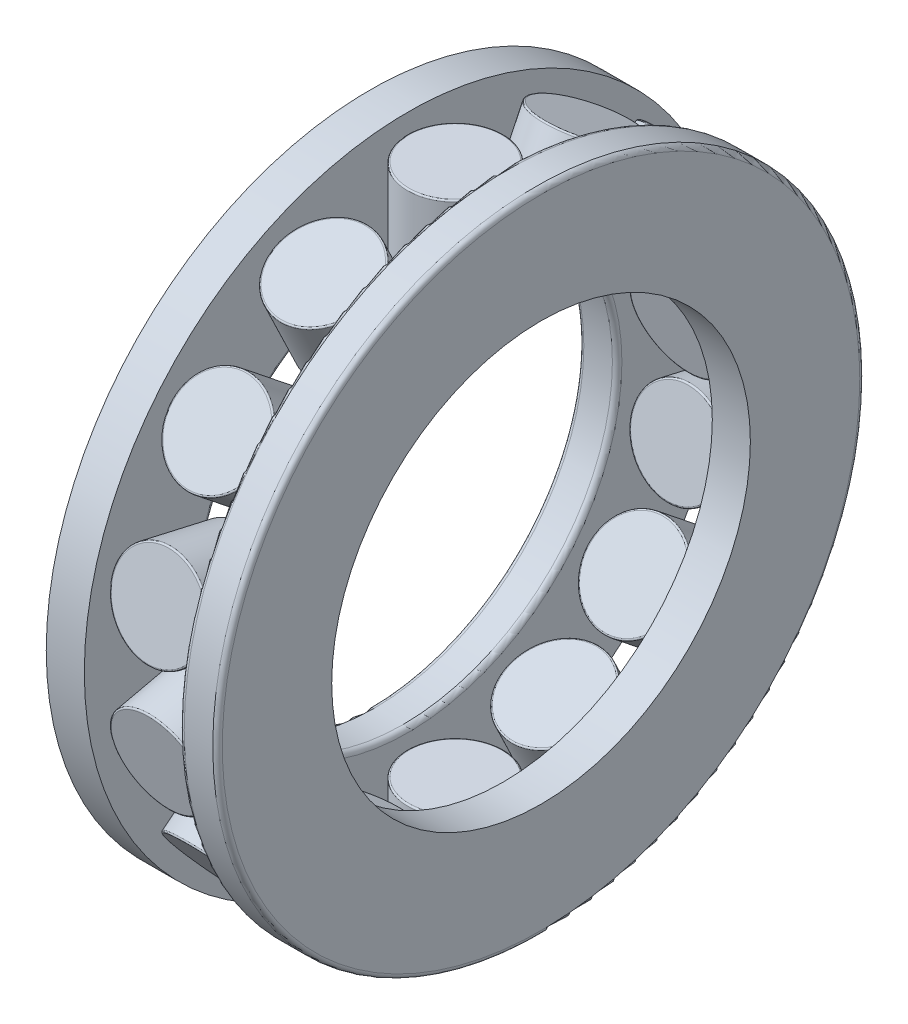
SolidWorks part; units mm, degrees
ref_plane "Plane1" through (0, 0, 0) normal (0, 0, 1) x (1, 0, 0)
ref_plane "Plane2" through (0, 0, 0) normal (0, 1, 0) x (1, 0, 0)
ref_plane "Plane3" through (0, 0, 0) normal (1, 0, 0) x (0, 0, -1)
other "Configuration Table"
sketch "Clipboard" plane through (0, 0, 0) normal (0, 0, 1) x (1, 0, 0)
  line L0 (-10, 0) -> (10, 0) construction
  line L1 (0, 0) -> (21.6965, -5.4095)
  line L2 (0, 0) -> (27.3662, 35.0271)
  line L3 (0, 0) -> (13.7666, -17.6205)
  line L4 (0, 0) -> (-22.3471, -0.7804)
sketch "InnRacSke" plane through (0, 0, 0) normal (0, 0, 1) x (1, 0, 0)
  line L1 (-7.9375, 34.925) -> (-14.2875, 34.925)
  line L2 (-14.2875, 34.925) -> (-14.2875, 53.975)
  line L3 (-14.2875, 53.975) -> (-7.9375, 53.975)
  line L4 (-7.9375, 53.975) -> (-7.9375, 34.925)
  line L5 (-34.925, 0) -> (34.925, 0) construction
  line L6 (0, 0) -> (0, 25.4) construction
revolve "Race" add sketch "InnRacSke" angle 360 about L5
ref_axis "Axis1" through (-50, 0, 0) along (1, 0, 0)
sketch "RolDetSke" plane through (0, 0, 0) normal (0, 0, 1) x (1, 0, 0)
  line L0 (0, 33.02) -> (0, 55.88) construction
  line L3 (0, 50.8) -> (7.7232, 50.8)
  line L4 (0, 50.8) -> (0, 38.1)
  line L5 (0, 38.1) -> (7.7232, 38.1)
  line L6 (7.9772, 50.546) -> (7.9772, 38.354)
  arc A0 (7.9772, 38.354) -> (7.7232, 38.1) centre (7.7232, 38.354) cw
  arc A1 (7.7232, 50.8) -> (7.9772, 50.546) centre (7.7232, 50.546) cw
revolve "RollerDetailed" add sketch "RolDetSke" angle 360 about L0
sketch "RolSimSke" plane through (0, 0, 0) normal (0, 0, 1) x (1, 0, 0)
  line L1 (-17.78, 0) -> (12.7, 0) construction
  line L3 (-7.7232, 50.8) -> (7.7232, 50.8)
  line L4 (-7.9772, 50.546) -> (-7.9772, 38.354)
  line L5 (-7.7232, 38.1) -> (7.7232, 38.1)
  line L6 (7.9772, 50.546) -> (7.9772, 38.354)
  arc A0 (-7.9772, 38.354) -> (-7.7232, 38.1) centre (-7.7232, 38.354) ccw
  arc A1 (-7.7232, 50.8) -> (-7.9772, 50.546) centre (-7.7232, 50.546) ccw
  arc A2 (7.9772, 50.546) -> (7.7232, 50.8) centre (7.7232, 50.546) ccw
  arc A3 (7.7232, 38.1) -> (7.9772, 38.354) centre (7.7232, 38.354) ccw
revolve "RollersSimplified" [suppressed] add sketch "RolSimSke" angle 360 about L1
mirror "Mirror1" about plane through (0, 0, 0) normal (1, 0, 0) of "Race"
fillet "Fillet" radius 0.7937 4 edges at (14.2875, 0, -53.975) (7.9375, 0, -53.975) (-14.2875, 0, -34.925) (-7.9375, 0, -34.925)
pattern_circular "RollersDetailed" count 14 every 25.714 about axis through (-50, 0, 0) along (1, 0, 0) of "RollerDetailed"
sketch "CagSpiSke" plane through (0, 0, 0) normal (0, 0, 1) x (1, 0, 0)
  line L0 (2.3932, 35.6235) -> (2.3932, 52.8955)
  line L1 (2.3932, 52.8955) -> (-2.3932, 52.8955)
  line L2 (-2.3932, 35.6235) -> (-2.3932, 52.8955)
  line L3 (-2.3932, 35.6235) -> (2.3932, 35.6235)
  line L4 (-34.925, 0) -> (34.925, 0) construction
  line L5 (0, 0) -> (0, 55.5677) construction
revolve "CageSpine" [suppressed] add sketch "CagSpiSke" angle 360 about L4
equation "\"BallCLRad@Clipboard\" =  ( \"OD@InnRacSke\" + \"ID@InnRacSke\" )  / 4"
equation "\"offset@RolDetSke\" = \"BallCLRad@Clipboard\" - \"Cyl_Len@RolDetSke\" / 2"
equation "\"Roller_diameter@RolDetSke\" = \"gap@InnRacSke\" * 1.005"
equation "\"Cyl_Len@RolSimSke\" = \"Cyl_Len@RolDetSke\""
equation "\"offset@RolSimSke\" = \"BallCLRad@Clipboard\" - \"Cyl_Len@RolSimSke\" / 2"
equation "\"Roller_diameter@RolSimSke\" = \"Roller_diameter@RolDetSke\""
equation "\"Halfdia@RolSimSke\" = \"Roller_diameter@RolSimSke\" / 2"
equation "\"Max_count@Clipboard\" = int( 3.14159265 / atn(( \"Roller_diameter@RolDetSke\" / 2) / sqr( \"offset@RolDetSke\"  *  \"offset@RolDetSke\" - ( \"Roller_diameter@RolDetSke\" / 2) *  ( \"Roller_diameter@RolDetSke\" "
equation "\"Max_count@Clipboard\" = ((sgn( \"Max_count@Clipboard\" - \"Count@Clipboard\" )-1)*( \"Max_count@Clipboard\" - \"Count@Clipboard\" ))/-2+ \"Count@Clipboard\""
equation "\"Count@RollersDetailed\" = int( \"Show_count@Clipboard\" ) "
equation "\"Count@RollersDetailed\" = ((sgn( \"Count@RollersDetailed\" - \"Max_count@Clipboard\" )-1)*( \"Count@RollersDetailed\" - \"Max_count@Clipboard\" ))/-2+ \"Max_count@Clipboard\""
equation "\"Count@RollersDetailed\" = ((sgn( \"Count@RollersDetailed\" - \"Min_count@Clipboard\" )+1)*( \"Count@RollersDetailed\" - \"Min_count@Clipboard\"))/2 +\"Min_count@Clipboard\""
equation "\"Angle@RollersDetailed\" = 360.0 / \"Max_count@Clipboard\""
equation "\"Angle@CageSpine\" =  \"Angle@RollersDetailed\" * ( \"Count@RollersDetailed\" -1 + int( \"Count@RollersDetailed\" / \"Max_count@Clipboard\" ) )  + 0.001 -  int( \"Count@RollersDetailed\" / \"Max_count@Clipboard\" "
equation "\"Angle@CageSpine\" =  \"Angle@CageSpine\" * int( \"Min_count@Clipboard\" / 2) + int(1 / \"Min_count@Clipboard\")  * 0.001"
equation "\"Thickness@CagSpiSke\" =  \"Roller_diameter@RolDetSke\" * 0.3"
equation "\"OD@CagSpiSke\" = \"OD@InnRacSke\" * 0.98"
equation "\"ID@CagSpiSke\" =  \"ID@InnRacSke\" * 1.02"
